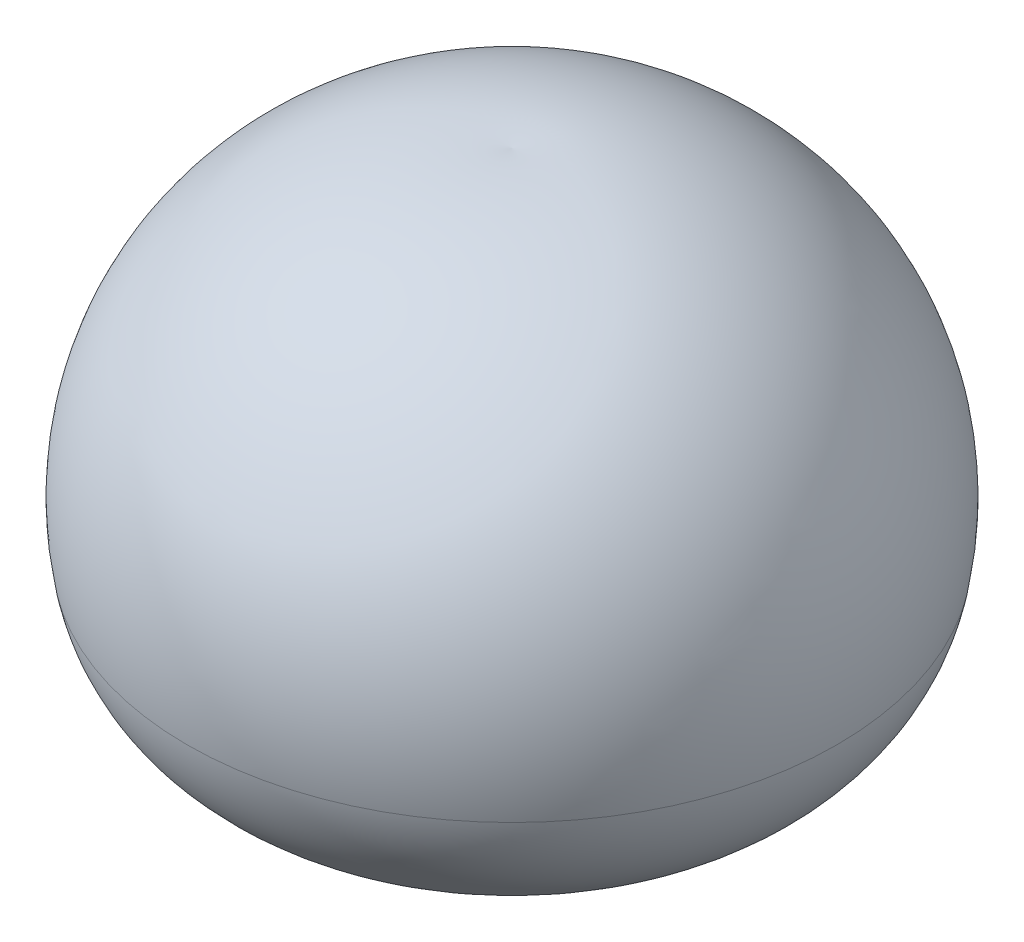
SolidWorks part; units mm, degrees
ref_plane "前视基准面" through (0, 0, 0) normal (0, 0, 1) x (1, 0, 0)
ref_plane "上视基准面" through (0, 0, 0) normal (0, 1, 0) x (1, 0, 0)
ref_plane "右视基准面" through (0, 0, 0) normal (1, 0, 0) x (0, 0, -1)
sketch "草图1" plane through (0, 0, 0) normal (0, 0, 1) x (1, 0, 0)
  line L0 (0, -83.2237) -> (0, -515.9454)
  line L14 (0, 3442.9712) -> (0, 1817.4139)
  line L15 (0, 4105.8144) -> (0, -1710.5326) construction
  arc A0 (3053.7171, 112.629) -> (0, 3442.9712) centre (250, 607) ccw
  arc A1 (0, -83.2237) -> (522.2537, 1288.7526) centre (250, 607) ccw
  arc A2 (0, -515.9454) -> (250, -814.611) centre (1402.2251, 403.8316) ccw
  arc A4 (522.2537, 1288.7526) -> (0, 1817.4139) centre (-902.2251, 403.8316) ccw
  arc A6 (250, -814.611) -> (3053.7171, 112.629) centre (1402.2251, 403.8316) ccw
revolve "旋转1" add sketch "草图1" angle 360 about L15
